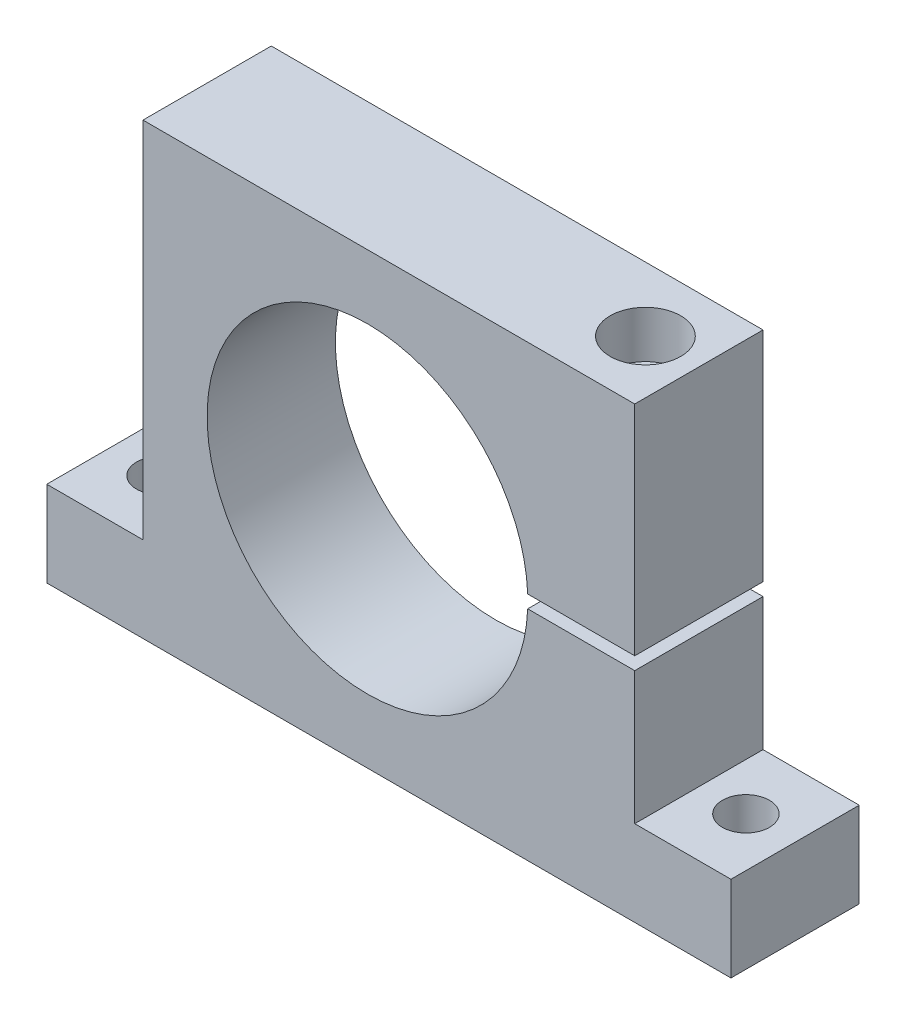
SolidWorks part; units mm, degrees
ref_plane "Front Plane" through (0, 0, 0) normal (0, 0, 1) x (1, 0, 0)
ref_plane "Top Plane" through (0, 0, 0) normal (0, 1, 0) x (1, 0, 0)
ref_plane "Right Plane" through (0, 0, 0) normal (1, 0, 0) x (0, 0, -1)
sketch "Sketch1" plane through (0, 0, 0) normal (0, 0, 1) x (1, 0, 0)
  line L0 (-52.5, 0) -> (62.5, 0) construction
  line L1 (0, 52.5) -> (0, -52.5) construction
  line L2 (-52.5, 52.5) -> (62.5, 52.5)
  line L3 (62.5, 52.5) -> (62.5, 1.5)
  line L4 (62.5, -32.5) -> (85, -32.5)
  line L5 (85, -32.5) -> (85, -52.5)
  line L6 (85, -52.5) -> (-75, -52.5)
  line L7 (-75, -52.5) -> (-75, -32.5)
  line L8 (-75, -32.5) -> (-52.5, -32.5)
  line L9 (-52.5, -32.5) -> (-52.5, 52.5)
  line L10 (62.5, 1.5) -> (37.47, 1.5)
  line L11 (62.5, -1.5) -> (37.47, -1.5)
  line L12 (62.5, -1.5) -> (62.5, -32.5)
  arc A0 (37.47, 1.5) -> (37.47, -1.5) centre (0, 0) ccw
  dimension "D1" = 75
  dimension "D2" = 52.5
  dimension "D3" = 22.5
  dimension "D4" = 105
  dimension "D5" = 20
  dimension "D7" = 52.5
  dimension "D9" = 160
  dimension "D11" = 3
extrude "Boss-Extrude1" add sketch "Sketch1" along normal mid plane 30
sketch "Sketch2" plane through (0, -52.5, 0) normal (0, -1, 0) x (1, 0, 0)
  line L0 (-75, 0) -> (85, 0) construction
  line L1 (-75, 15) -> (-75, -15) construction
  line L2 (85, 15) -> (85, -15) construction
  circle A0 centre (-63.5, 0) radius 5.5
  circle A1 centre (73.5, 0) radius 5.5
  dimension "D3" = 11
  dimension "D1" = 137
  dimension "D2" = 11.5
extrude "Cut-Extrude1" cut sketch "Sketch2" against normal blind 20
sketch "Sketch3" plane through (0, 0, 0) normal (0, 0, 1) x (1, 0, 0)
  line L0 (50, 52.5) -> (50, -52.5) construction
  line L1 (62.5, 52.5) -> (-52.5, 52.5) construction
  line L2 (-75, -52.5) -> (85, -52.5) construction
  line L3 (50, 52.5) -> (58.25, 52.5)
  line L4 (58.25, 52.5) -> (58.25, 41.5)
  line L5 (58.25, 41.5) -> (55, 41.5)
  line L6 (55, 41.5) -> (55, -37.5)
  line L7 (55, -37.5) -> (50, -40.5043)
  line L8 (50, -40.5043) -> (50, 52.5)
  line L9 (85, -52.5) -> (85, -32.5) construction
  dimension "D1" = 59
  dimension "D2" = 10
  dimension "D3" = 11
  dimension "D4" = 16.5
  dimension "D5" = 35
  dimension "D6" = 90
revolve "Cut-Revolve1" cut sketch "Sketch3" angle 360 about L0
